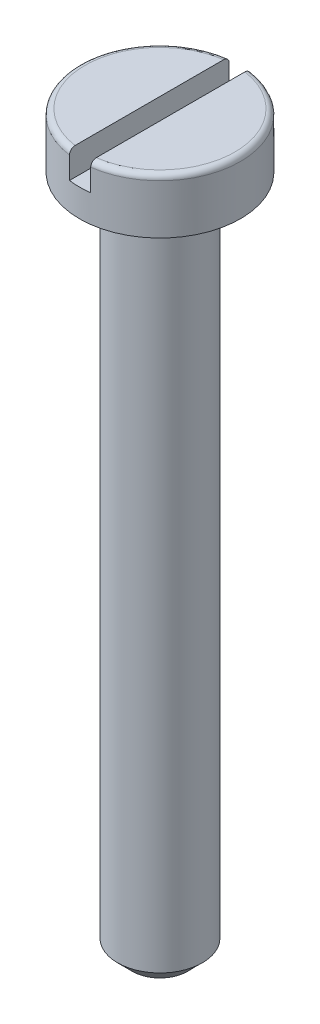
SolidWorks part; units mm, degrees
ref_plane "Face" through (0, 0, 0) normal (0, 0, 1) x (1, 0, 0)
ref_plane "Dessus" through (0, 0, 0) normal (0, 1, 0) x (1, 0, 0)
ref_plane "Droite" through (0, 0, 0) normal (1, 0, 0) x (0, 0, -1)
sketch "Esquisse1" plane through (0, 0, 0) normal (0, 1, 0) x (1, 0, 0)
  circle A0 centre (0, 0) radius 1
  dimension "Diamètre nominal" = 2
extrude "Base-Extrusion" add sketch "Esquisse1" against normal blind 16
chamfer "Chanfrein1" distance 0.35 angle 45 1 edges at (0, -16, 1)
sketch "Esquisse2" plane through (0, 0, 0) normal (0, 0, 1) x (1, 0, 0)
  line L0 (0, 1.3) -> (0, 0)
  line L2 (0, 0) -> (1.9, 0)
  line L4 (0, 1.3) -> (1.77, 1.3)
  line L5 (1.9, 0) -> (1.9, 1.17)
  line L7 (0, 1.3) -> (0, -16) construction
  line L8 (0, -15.65) -> (0, 0) construction
  line L9 (-0.65, -16) -> (0.65, -16) construction
  arc A0 (1.9, 1.17) -> (1.77, 1.3) centre (1.77, 1.17) ccw
  dimension "D2" = 0.13
  dimension "D1" = 3.8
  dimension "Hauteur tête" = 1.3
revolve "Boss.-Révol.1" add sketch "Esquisse2" angle 360 about L7
sketch "Esquisse3" plane through (0, 1.3, 0) normal (0, 1, 0) x (-1, 0, 0)
  line L0 (0, -1.9) -> (0, 1.9) construction
  line L1 (0.25, -1.9) -> (-0.25, -1.9)
  line L2 (0.25, 1.9) -> (-0.25, 1.9)
  line L3 (0.25, -1.9) -> (0.25, 1.9)
  line L4 (-0.25, -1.9) -> (-0.25, 1.9)
  circle A0 centre (0, 0) radius 1.9 construction
  dimension "Largeur fente" = 0.5
extrude "Enlèv. mat.-Extru.1" cut sketch "Esquisse3" against normal blind 0.65
